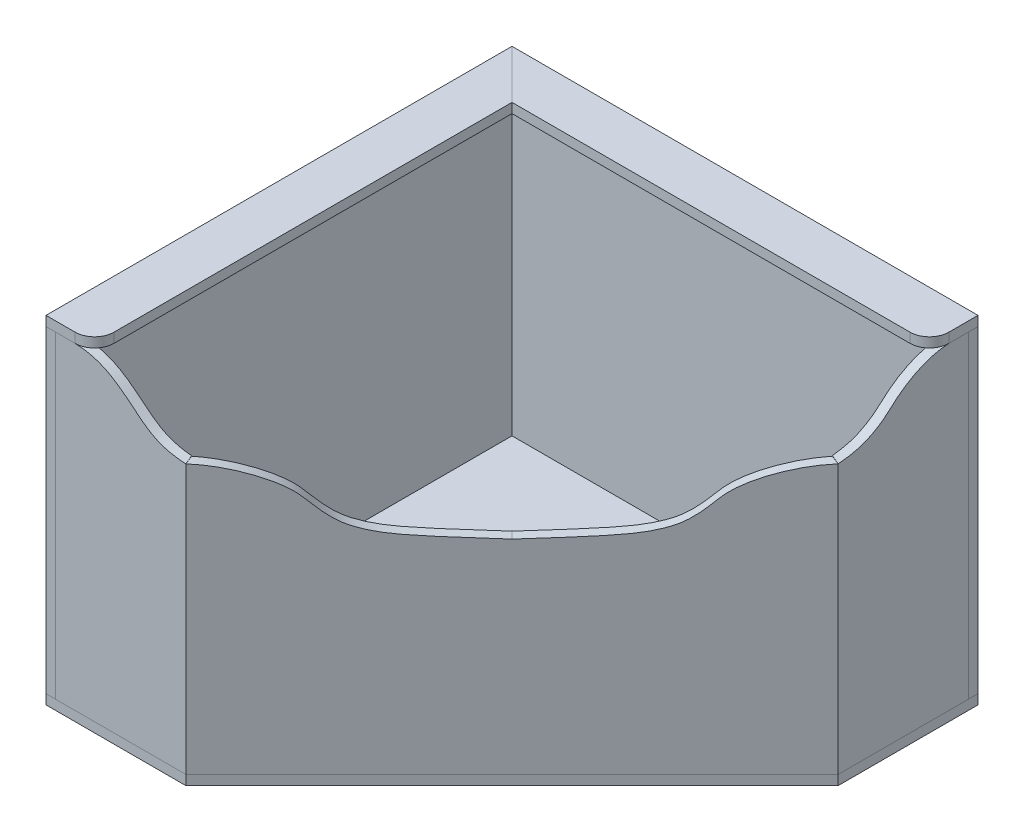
SolidWorks part; units mm, degrees
other "Camera1"
ref_plane "Front Plane" through (0, 0, 0) normal (0, 0, 1) x (1, 0, 0)
ref_plane "Top Plane" through (0, 0, 0) normal (0, 1, 0) x (1, 0, 0)
ref_plane "Right Plane" through (0, 0, 0) normal (1, 0, 0) x (0, 0, -1)
sketch "Sketch1" plane through (0, 0, 0) normal (0, 1, 0) x (1, 0, 0)
  line L1 (0, 0) -> (25.4, 0)
  line L2 (0, 0) -> (0, 1219.2)
  line L3 (0, 1219.2) -> (25.4, 1219.2)
  line L4 (25.4, 0) -> (25.4, 1219.2)
  dimension "D1" = 25.4
  dimension "D2" = 1219.2
extrude "Boss-Extrude1" add sketch "Sketch1" along normal blind 831.85
sketch "Sketch2" plane through (0, 0, 0) normal (0, 1, 0) x (1, 0, 0)
  line L1 (25.4, 1219.2) -> (1219.2, 1219.2)
  line L2 (25.4, 1219.2) -> (25.4, 1193.8)
  line L3 (25.4, 1193.8) -> (1219.2, 1193.8)
  line L4 (1219.2, 1219.2) -> (1219.2, 1193.8)
  dimension "D1" = 25.4
  dimension "D2" = 1193.8
extrude "Boss-Extrude2" add sketch "Sketch2" along normal blind 831.85 separate body
sketch "Sketch3" plane through (0, 0, 0) normal (0, 1, 0) x (1, 0, 0)
  line L0 (1219.2, 853.079) -> (366.121, 0) construction
  line L1 (25.4, 0) -> (366.121, 0)
  line L2 (25.4, 0) -> (25.4, 25.4)
  line L3 (25.4, 25.4) -> (355.6, 25.4)
  line L4 (366.121, 0) -> (355.6, 25.4)
  line L5 (1219.2, 1193.8) -> (1193.8, 1193.8)
  line L6 (1219.2, 1193.8) -> (1219.2, 853.079)
  line L7 (1219.2, 853.079) -> (1193.8, 863.6)
  line L8 (1193.8, 1193.8) -> (1193.8, 863.6)
  line L9 (355.6, 25.4) -> (1193.8, 863.6) construction
  dimension "D1" = 25.4
  dimension "D2" = 25.4
  dimension "D3" = 330.2
  dimension "D4" = 330.2
  dimension "D5" = 67.5
  dimension "D6" = 67.5
extrude "Boss-Extrude3" add sketch "Sketch3" along normal blind 831.85 separate body
sketch "Sketch5" plane through (0, 0, 0) normal (0, -1, 0) x (1, 0, 0)
  line L0 (0, 0) -> (366.121, 0)
  line L1 (366.121, 0) -> (1219.2, -853.079)
  line L2 (1219.2, -853.079) -> (1219.2, -1219.2)
  line L3 (1219.2, -1219.2) -> (0, -1219.2)
  line L4 (0, -1219.2) -> (0, 0)
  line L5 (285.75, -260.35) -> (285.75, 0) construction
  circle A0 centre (285.75, -260.35) radius 39.6875
  dimension "D2" = 79.375
  dimension "D1" = 285.75
  dimension "D3" = 260.35
extrude "Boss-Extrude5" add sketch "Sketch5" along normal blind 25.4 separate body
sketch "Sketch6" plane through (0, 0, 0) normal (0, 1, 0) x (1, 0, 0)
  circle A0 centre (285.75, 260.35) radius 53.975
  circle A4 centre (285.75, 260.35) radius 39.6875 construction
  dimension "D1" = 107.95
extrude "Cut-Extrude1" cut sketch "Sketch6" against normal blind 3.175
sketch3d "3DSketch2" plane through (0, 0, 0) normal (0, 0, 1) x (1, 0, 0)
  dimension "D1" = 25.4
sketch "Sketch23" plane through (183.0605, 0, 183.0605) normal (0.7071, 0, 0.7071) x (0.7071, 0, -0.7071)
  line L0 (1465.3225, 533.4) -> (258.8867, 533.4) construction
  line L3 (862.1046, 533.4) -> (862.1046, 0) construction
  line L4 (1465.3225, 0) -> (258.8867, 0) construction
  line L11 (1465.3225, 831.85) -> (1465.3225, 0) construction
  line L12 (258.8867, 831.85) -> (258.8867, 0) construction
  spline S0 degree 3 poles (862.1046, 533.4) (1032.8698, 539.9136) (1091.6882, 544.5165) (1167.8654, 564.7194) (1200.9556, 581.4759) (1284.0389, 665.0345) (1392.7263, 700.7421) (1465.3225, 703.8157) knots 0 0 0 0 0.332635 0.40635 0.700396 0.763437 1 1 1 1
  spline S1 degree 3 poles (862.1046, 533.4) (691.3394, 539.9136) (632.521, 544.5165) (556.3438, 564.7194) (523.2535, 581.4759) (440.1703, 665.0345) (331.4829, 700.7421) (258.8867, 703.8157) knots 0 0 0 0 0.332635 0.40635 0.700396 0.763437 1 1 1 1
  dimension "D1" = 533.4
surface "Surface-Extrude3" sketch "Sketch23" parameters "D1"=25.4, "D3"=0
sketch "Sketch24" plane through (0, 0, 0) normal (0, 1, 0) x (1, 0, 0)
  line L0 (366.121, 0) -> (355.6, 25.4)
  line L1 (355.6, 25.4) -> (1193.8, 863.6)
  line L2 (1193.8, 863.6) -> (1219.2, 853.079)
  line L3 (1219.2, 853.079) -> (366.121, 0)
  line L4 (792.6605, 426.5395) -> (655.0274, 564.1726) construction
extrude "Boss-Extrude11" add sketch "Sketch24" along normal up to surface (703.8157 mm away) separate body
sketch "Sketch25" plane through (1219.2, 0, 0) normal (1, 0, 0) x (0, 0, -1)
  line L0 (853.079, 831.85) -> (1193.8, 831.85) construction
  line L1 (1143, 831.85) -> (1193.8, 831.85)
  line L2 (853.079, 703.8157) -> (853.079, 831.85)
  line L3 (853.079, 831.85) -> (1143, 831.85)
  line L4 (941.217, 726.186) -> (941.217, 831.85) construction
  line L5 (941.217, 726.186) -> (853.079, 726.186) construction
  line L6 (1014.877, 781.812) -> (1014.877, 831.85) construction
  spline S0 degree 3 poles (853.079, 703.8157) (877.8168, 705.6574) (911.4869, 710.3079) (978.5908, 745.8946) (995.3874, 773.9217) (1085.8732, 828.8457) (1143, 831.85) knots 0 0 0 0 0.275879 0.34347 0.67591 1 1 1 1
  dimension "D1" = 50.8
  dimension "D2" = 88.138
  dimension "D3" = 105.664
  dimension "D4" = 50.038
  dimension "D5" = 73.66
extrude "Cut-Extrude2" cut sketch "Sketch25" against normal blind 25.4 contours S0 M5 M4
sketch "Sketch26" plane through (0, 0, 0) normal (0, 0, 1) x (1, 0, 0)
  line L0 (25.4, 831.85) -> (76.2, 831.85)
  line L1 (25.4, 831.85) -> (366.121, 831.85) construction
  line L2 (204.323, 781.812) -> (204.323, 831.85) construction
  line L3 (277.983, 726.186) -> (277.983, 831.85) construction
  line L4 (366.121, 831.85) -> (366.121, 0) construction
  line L5 (76.2, 831.85) -> (366.121, 831.85)
  line L6 (366.121, 831.85) -> (366.121, 703.8157)
  spline S0 degree 3 poles (76.2, 831.85) (128.9995, 830.6746) (194.0624, 796.0892) (274.9421, 718.711) (331.7626, 705.2725) (366.121, 703.8157) knots 0 0 0 0 0.428785 0.71653 1 1 1 1
  dimension "D1" = 50.8
  dimension "D2" = 50.038
  dimension "D3" = 105.664
  dimension "D4" = 73.66
  dimension "D5" = 88.138
extrude "Cut-Extrude3" cut sketch "Sketch26" against normal blind 25.4 contours S0 M6 M5
sketch "Sketch27" plane through (0, 831.85, 0) normal (0, 1, 0) x (1, 0, 0)
  line L0 (0, 1219.2) -> (127, 1092.2)
  line L1 (127, 1092.2) -> (1168.4, 1092.2)
  line L2 (0, 1219.2) -> (1219.2, 1219.2)
  line L3 (1219.2, 1143) -> (1219.2, 1219.2)
  arc A0 (1168.4, 1092.2) -> (1219.2, 1143) centre (1168.4, 1143) ccw
  dimension "D3" = 50.8
  dimension "D1" = 45
  dimension "D2" = 127
extrude "Boss-Extrude12" add sketch "Sketch27" along normal blind 25.4 separate body
sketch "Sketch28" plane through (0, 831.85, 0) normal (0, 1, 0) x (1, 0, 0)
  line L0 (0, 0) -> (0, 1219.2)
  line L1 (0, 1219.2) -> (127, 1092.2)
  line L2 (127, 1092.2) -> (127, 50.8)
  line L3 (76.2, 0) -> (0, 0)
  arc A0 (127, 50.8) -> (76.2, 0) centre (76.2, 50.8) cw
  dimension "D1" = 50.8
extrude "Boss-Extrude13" add sketch "Sketch28" along normal blind 25.4 separate body
